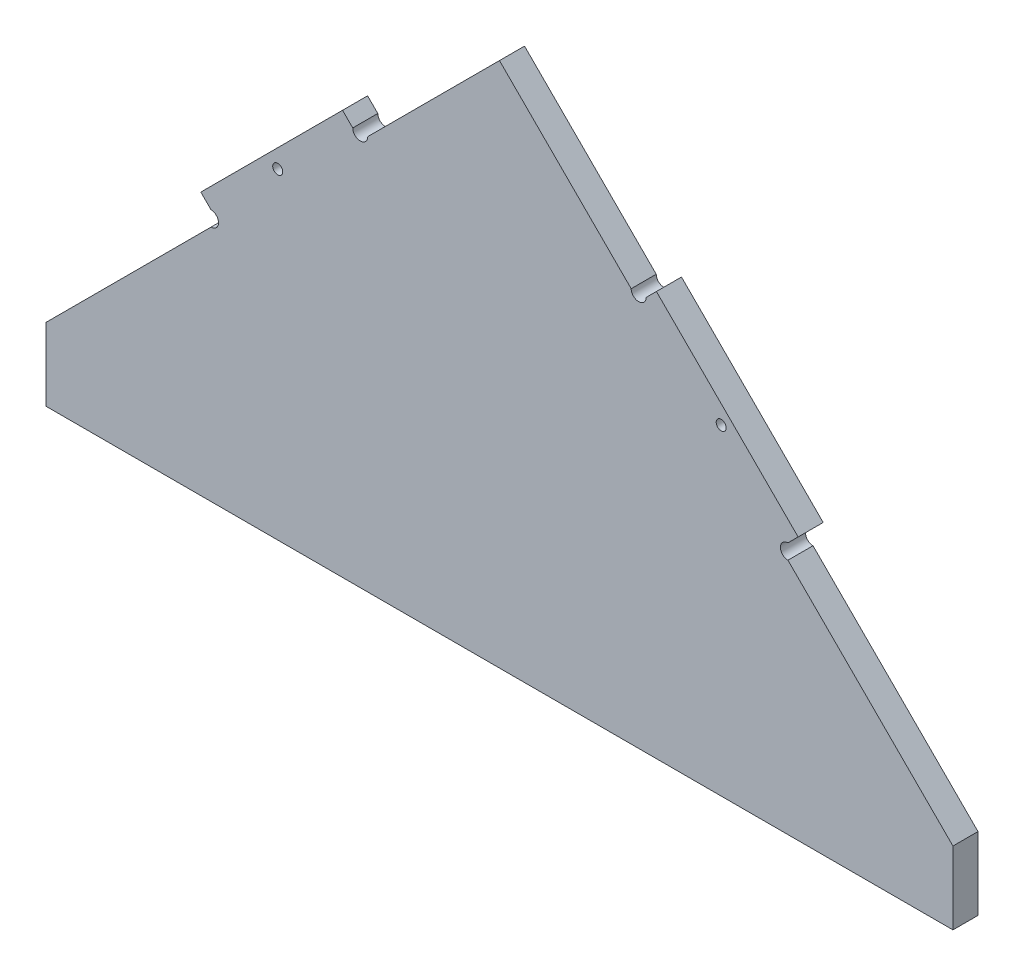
SolidWorks part; units mm, degrees
ref_plane "Plan de face" through (0, 0, 0) normal (0, 0, 1) x (1, 0, 0)
ref_plane "Plan de dessus" through (0, 0, 0) normal (0, 1, 0) x (1, 0, 0)
ref_plane "Plan de droite" through (0, 0, 0) normal (1, 0, 0) x (0, 0, -1)
sketch "Esquisse1" plane through (0, 0, 0) normal (0, 0, 1) x (1, 0, 0)
  line L0 (90.5, 0) -> (-90.5, 0)
  line L1 (-31.3198, 80.7513) -> (-56.0685, 48.9315) construction
  line L2 (-56.0685, 48.9315) -> (-76.2084, 48.9315) construction
  line L3 (0, 105) -> (0, 0) construction
  line L4 (90.5, 14.5) -> (57.5685, 47.4315)
  line L5 (90.5, 0) -> (90.5, 14.5)
  line L6 (-27.7843, 77.2157) -> (-27.7843, 93.005) construction
  line L7 (-26.2843, 78.7157) -> (0, 105)
  line L8 (-59.6041, 52.467) -> (-57.5685, 50.4315)
  line L9 (-31.3198, 80.7513) -> (-59.6041, 52.467)
  line L10 (29.2843, 78.7157) -> (31.3198, 80.7513)
  line L11 (31.3198, 80.7513) -> (59.6041, 52.467)
  line L12 (59.6041, 52.467) -> (57.5685, 50.4315)
  line L13 (26.2843, 78.7157) -> (0, 105)
  line L14 (-29.2843, 78.7157) -> (-31.3198, 80.7513)
  line L15 (-90.5, 0) -> (-90.5, 14.5)
  line L16 (27.7843, 77.2157) -> (27.7843, 93.005) construction
  line L17 (56.0685, 48.9315) -> (76.2084, 48.9315) construction
  line L18 (-90.5, 14.5) -> (-57.5685, 47.4315)
  line L19 (31.3198, 80.7513) -> (56.0685, 48.9315) construction
  circle A0 centre (-44.2534, 64.1224) radius 1
  arc A1 (-26.2843, 78.7157) -> (-29.2843, 78.7157) centre (-27.7843, 78.7157) cw
  arc A2 (57.5685, 50.4315) -> (57.5685, 47.4315) centre (57.5685, 48.9315) ccw
  arc A3 (26.2843, 78.7157) -> (29.2843, 78.7157) centre (27.7843, 78.7157) ccw
  arc A4 (-57.5685, 50.4315) -> (-57.5685, 47.4315) centre (-57.5685, 48.9315) cw
  circle A5 centre (44.2534, 64.1224) radius 1
  dimension "D1" = 90
  dimension "D2" = 90
  dimension "D3" = 181
extrude "Boss.-Extru.1" add sketch "Esquisse1" along normal blind 5
